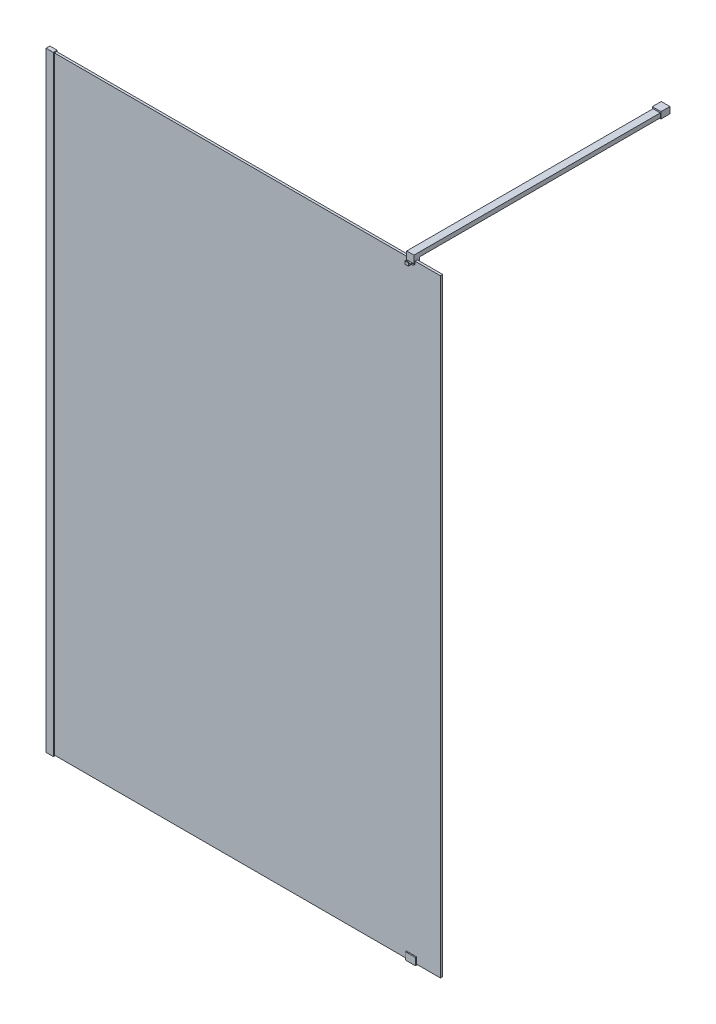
SolidWorks part; units mm, degrees
ref_plane "Płaszczyzna przednia" through (0, 0, 0) normal (0, 0, 1) x (1, 0, 0)
ref_plane "Płaszczyzna górna" through (0, 0, 0) normal (0, 1, 0) x (1, 0, 0)
ref_plane "Płaszczyzna prawa" through (0, 0, 0) normal (1, 0, 0) x (0, 0, -1)
sketch "Szkic1" plane through (0, 0, 0) normal (0, 1, 0) x (1, 0, 0)
  line L0 (0, 0) -> (0, 13.3)
  line L2 (0, 13.3) -> (25, 13.3)
  line L3 (25, 13.3) -> (25, 11.4)
  line L4 (25, 11.4) -> (11.45, 11.4)
  line L5 (11.45, 11.4) -> (11.45, 3.4)
  line L6 (11.45, 3.4) -> (25, 3.4)
  line L7 (25, 3.4) -> (25, 0)
  line L8 (25, 0) -> (0, 0)
  dimension "D1" = 13.3
  dimension "D4" = 1.9
  dimension "D5" = 8
  dimension "D6" = 3.4
  dimension "D7" = 13.55
  dimension "D8" = 25
extrude "Dodanie-wyciągnięcie1" add sketch "Szkic1" along normal blind 2100
sketch "Szkic2" plane through (0, 0, 0) normal (0, -1, 0) x (1, 0, 0)
  line L0 (11.45, -3.4) -> (1358.45, -3.4)
  line L1 (11.45, -3.4) -> (11.45, -11.4)
  line L2 (1358.45, -3.4) -> (1358.45, -11.4)
  line L3 (11.45, -11.4) -> (1358.45, -11.4)
  line L4 (11.45, -11.4) -> (25, -11.4) construction
  dimension "D1" = 1347
extrude "Dodanie-wyciągnięcie2" add sketch "Szkic2" against normal blind 2100 separate body
sketch "Szkic4" plane through (0, 2100, 0) normal (0, 1, 0) x (1, 0, 0)
  line L1 (25, 13.3) -> (0, 13.3) construction
  line L2 (25, 11.4) -> (25, 13.3) construction
  line L3 (0, 13.3) -> (0, 0) construction
  line L5 (0, 0) -> (25, 0) construction
  line L7 (25, 13.3) -> (0, 13.3)
  line L8 (25, 0) -> (25, 13.3)
  line L9 (0, 13.3) -> (0, 0)
  line L11 (0, 0) -> (25, 0)
extrude "Dodanie-wyciągnięcie3" add sketch "Szkic4" along normal blind 3
sketch "Szkic5" plane through (0, 0, 0) normal (0, -1, 0) x (1, 0, 0)
  line L1 (0, 0) -> (25, 0) construction
  line L2 (25, 0) -> (25, -3.4) construction
  line L3 (0, -13.3) -> (0, 0) construction
  line L5 (25, -13.3) -> (0, -13.3) construction
  line L7 (0, 0) -> (25, 0)
  line L8 (25, 0) -> (25, -13.3)
  line L9 (0, -13.3) -> (0, 0)
  line L11 (25, -13.3) -> (0, -13.3)
extrude "Dodanie-wyciągnięcie4" add sketch "Szkic5" along normal blind 3
ref_plane "Płaszczyzna1" through (1258.45, 0, 0) normal (1, 0, 0) x (0, 0, -1)
sketch "Szkic6" plane through (1258.45, 0, 0) normal (1, 0, 0) x (0, 0, -1)
  line L0 (11.4, 22) -> (15.75, 22)
  line L1 (15.75, 22) -> (15.75, -3)
  line L2 (15.75, -3) -> (-0.35, -3)
  line L3 (-0.35, -3) -> (-0.35, 22)
  line L4 (-0.35, 22) -> (3.4, 22)
  line L5 (11.4, 22) -> (11.4, 0)
  line L6 (11.4, 0) -> (11.4, 2100)
  line L7 (11.4, 0) -> (11.4, 2100) construction
  line L8 (3.4, 2100) -> (3.4, 0)
  line L9 (3.4, 2100) -> (3.4, 0) construction
  line L10 (11.4, 0) -> (3.4, 0)
  line L11 (3.4, 0) -> (3.4, 22)
  dimension "D1" = 4.35
  dimension "D2" = 25
  dimension "D3" = 3
  dimension "D4" = 3.75
extrude "Dodanie-wyciągnięcie5" add sketch "Szkic6" along normal mid plane 35 separate body
sketch "Szkic7" plane through (1258.45, 0, 0) normal (1, 0, 0) x (0, 0, -1)
  line L0 (3.4, 2100) -> (3.4, 0) construction
  line L1 (-0.6, 2120) -> (19.4, 2120)
  line L2 (3.4, 2100) -> (3.4, 0) construction
  line L4 (11.4, 2100) -> (3.4, 2100) construction
  line L13 (11.4, 2100) -> (11.4, 0) construction
  line L20 (19.4, 2120) -> (19.4, 2090)
  line L25 (19.4, 2090) -> (11.4, 2090)
  line L26 (11.4, 2090) -> (11.4, 2100)
  line L27 (11.4, 2100) -> (3.4, 2100)
  line L28 (3.4, 2100) -> (3.4, 2090)
  line L29 (3.4, 2090) -> (-13.37, 2090)
  line L30 (-13.37, 2090) -> (-13.37, 2100)
  line L31 (-13.37, 2100) -> (-10.37, 2100)
  line L32 (-10.37, 2100) -> (-9.8451, 2094)
  line L33 (-9.8451, 2094) -> (-0.6, 2094)
  line L34 (-0.6, 2094) -> (-0.6, 2120)
  dimension "D3" = 20
  dimension "D4" = 30
  dimension "D5" = 16.77
  dimension "D6" = 4
  dimension "D14" = 8
  dimension "D21" = 10
  dimension "D22" = 4
  dimension "D23" = 3
  dimension "D24" = 95
extrude "Dodanie-wyciągnięcie6" add sketch "Szkic7" along normal mid plane 25 separate body
sketch "Szkic8" plane through (0, 2100, 0) normal (0, 1, 0) x (1, 0, 0)
  line L0 (1245.95, -0.6) -> (1252.45, -3.631)
  line L1 (1252.45, -3.631) -> (1252.45, -13.37)
  line L2 (1270.95, -0.6) -> (1264.45, -3.631)
  line L3 (1264.45, -3.631) -> (1264.45, -13.37)
  line L4 (1258.45, -10.37) -> (1258.45, 156.6902) construction
  line L5 (1270.95, -10.37) -> (1245.95, -10.37) construction
  line L6 (1252.45, -13.37) -> (1264.45, -13.37)
  line L7 (1270.95, -13.37) -> (1245.95, -13.37) construction
  dimension "D1" = 12
  dimension "D2" = 115
extrude "Wytnij-wyciągnięcie1" cut sketch "Szkic8" against normal through all and the other way through all
sketch "Szkic10" plane through (0, 2120, 0) normal (0, 1, 0) x (1, 0, 0)
  line L0 (1258.45, 31.9) -> (1258.45, 19.4) construction
  line L1 (1245.95, 881.03) -> (1270.95, 881.03)
  line L2 (1245.95, 881.03) -> (1245.95, 19.4)
  line L3 (1245.95, 19.4) -> (1270.95, 19.4)
  line L4 (1270.95, 19.4) -> (1245.95, 19.4) construction
  line L5 (1245.95, 19.4) -> (1245.95, -0.6) construction
  line L6 (1270.95, 881.03) -> (1270.95, 19.4)
  point P4 (1258.45, 31.9)
  dimension "D2" = 861.63
  dimension "D1" = 25
  dimension "D3" = 12.5
extrude "Dodanie-wyciągnięcie7" add sketch "Szkic10" against normal blind 15
sketch "Szkic14" plane through (0, 0, -881.03) normal (0, 0, -1) x (-1, 0, 0)
  line L1 (-1273.45, 2125) -> (-1243.45, 2125)
  line L2 (-1273.45, 2125) -> (-1273.45, 2103)
  line L3 (-1273.45, 2103) -> (-1243.45, 2103)
  line L4 (-1243.45, 2125) -> (-1243.45, 2103)
  line L5 (-1273.45, 2125) -> (-1243.45, 2103) construction
  line L6 (-1273.45, 2103) -> (-1243.45, 2125) construction
  line L7 (-1258.45, 2120) -> (-1258.45, 2114) construction
  line L8 (-1270.95, 2120) -> (-1245.95, 2120) construction
  line L9 (-1270.95, 2105) -> (-1245.95, 2105) construction
  point P0 (-1258.45, 2114)
  dimension "D1" = 30
  dimension "D2" = 22
  dimension "D3" = 2
extrude "Dodanie-wyciągnięcie8" add sketch "Szkic14" against normal blind 31
